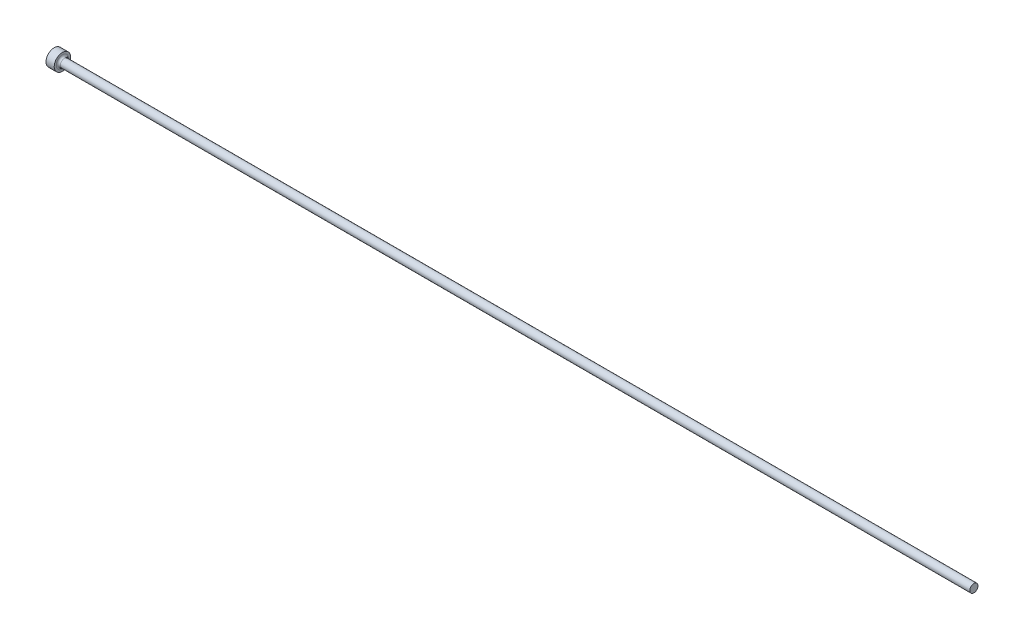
SolidWorks part; units mm, degrees
ref_plane "Front Plane" through (0, 0, 0) normal (0, 0, 1) x (1, 0, 0)
ref_plane "Top Plane" through (0, 0, 0) normal (0, 1, 0) x (1, 0, 0)
ref_plane "Right Plane" through (0, 0, 0) normal (1, 0, 0) x (0, 0, -1)
sketch "Sketch1" plane through (0, 0, 0) normal (0, 0, 1) x (1, 0, 0)
  line L0 (0, 0) -> (0, 3.175)
  line L1 (0, 3.175) -> (3.175, 3.175)
  line L2 (3.175, 3.175) -> (3.175, 2.3749)
  line L3 (3.9624, 1.5875) -> (355.6, 1.5875)
  line L4 (355.6, 1.5875) -> (355.6, 0)
  line L5 (355.6, 0) -> (0, 0)
  line L6 (355.6, 0) -> (0, 0) construction
  line L7 (0, 0) -> (-10.4771, 0) construction
  line L8 (355.6, 0) -> (1002.3976, 0) construction
  arc A0 (3.9624, 1.5875) -> (3.175, 2.3749) centre (3.9624, 2.3749) cw
  dimension "D1" = 0.7874
  dimension "HeadDia" = 6.35
  dimension "HeadThickness" = 3.175
  dimension "PinDia" = 3.175
  dimension "overall" = 355.6
revolve "PIN" add sketch "Sketch1" angle 360 about L6
